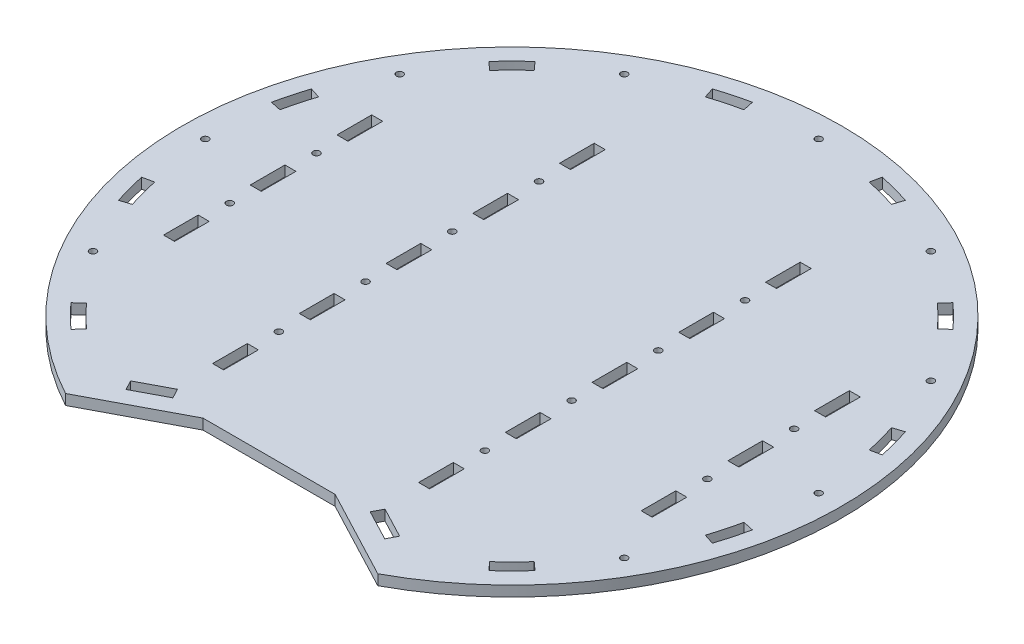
SolidWorks part; units mm, degrees
ref_plane "Front Plane" through (0, 0, 0) normal (0, 0, 1) x (1, 0, 0)
ref_plane "Top Plane" through (0, 0, 0) normal (0, 1, 0) x (1, 0, 0)
ref_plane "Right Plane" through (0, 0, 0) normal (1, 0, 0) x (0, 0, -1)
sketch "Sketch1" plane through (0, 0, 0) normal (0, 1, 0) x (1, 0, 0)
  line L0 (-106.3364, -157.4566) -> (-42.1421, -123.65) construction
  line L17 (-42.1421, -123.65) -> (42.1421, -123.65) construction
  line L18 (0, 190) -> (0, -190) construction
  line L19 (-137.675, -10) -> (-137.675, -40) construction
  line L20 (-190, 0) -> (190, 0) construction
  line L33 (140.85, -40) -> (140.85, -60)
  line L34 (-134.5, 40) -> (-140.85, 40)
  line L35 (-134.5, 40) -> (-134.5, 60)
  line L36 (-134.5, 60) -> (-140.85, 60)
  line L37 (-140.85, 40) -> (-140.85, 60)
  line L38 (-134.5, 10) -> (-140.85, 10)
  line L39 (-134.5, 10) -> (-134.5, -10)
  line L40 (-134.5, -10) -> (-140.85, -10)
  line L41 (-140.85, 10) -> (-140.85, -10)
  line L46 (-134.5, -40) -> (-140.85, -40)
  line L47 (-134.5, -40) -> (-134.5, -60)
  line L48 (-134.5, -60) -> (-140.85, -60)
  line L49 (-140.85, -40) -> (-140.85, -60)
  line L50 (134.5, -60) -> (140.85, -60)
  line L51 (134.5, -40) -> (134.5, -60)
  line L52 (134.5, -40) -> (140.85, -40)
  line L53 (140.85, 10) -> (140.85, -10)
  line L54 (134.5, -10) -> (140.85, -10)
  line L55 (134.5, 10) -> (134.5, -10)
  line L56 (134.5, 10) -> (140.85, 10)
  line L57 (140.85, 40) -> (140.85, 60)
  line L58 (134.5, 60) -> (140.85, 60)
  line L59 (134.5, 40) -> (134.5, 60)
  line L60 (134.5, 40) -> (140.85, 40)
  line L73 (42.1421, -123.65) -> (106.3364, -157.4566) construction
  line L86 (0, 0) -> (-37.4241, 176.0666) construction
  line L99 (-155.3051, -190) -> (147.1552, -190) construction
  line L100 (-128.4523, -140) -> (128.4523, -140) construction
  line L101 (-90, -167.332) -> (-38.1, -140)
  line L102 (-38.1, -140) -> (38.1, -140)
  line L103 (38.1, -140) -> (90, -167.332)
  line L104 (-53.6608, 165.151) -> (-55.6231, 171.1902)
  line L105 (0, 0) -> (-55.6231, 171.1902) construction
  line L126 (-137.675, 10) -> (-137.675, 40) construction
  line L127 (-37.4241, 176.0666) -> (-36.1039, 169.8553)
  line L128 (-100.2255, -161.4151) -> (-40.5722, -130) construction
  line L129 (-120.4435, 133.7661) -> (-116.1945, 129.0471)
  line L130 (-40.5722, -130) -> (40.5722, -130) construction
  line L131 (40.5722, -130) -> (100.2255, -161.4151) construction
  line L132 (-129.0471, 116.1945) -> (-133.7661, 120.4435)
  line L133 (-171.1902, 55.6231) -> (-165.151, 53.6608)
  line L134 (-169.8553, 36.1039) -> (-176.0666, 37.4241)
  line L135 (-176.0666, -37.4241) -> (-169.8553, -36.1039)
  line L136 (-165.151, -53.6608) -> (-171.1902, -55.6231)
  line L137 (-133.7661, -120.4435) -> (-129.0471, -116.1945)
  line L138 (-116.1945, -129.0471) -> (-120.4435, -133.7661)
  line L139 (0, 0) -> (-36.1039, 169.8553) construction
  line L140 (56.2033, -10) -> (62.5533, -10)
  line L141 (116.1945, -129.0471) -> (120.4435, -133.7661)
  line L142 (133.7661, -120.4435) -> (129.0471, -116.1945)
  line L143 (165.151, -53.6608) -> (171.1902, -55.6231)
  line L144 (176.0666, -37.4241) -> (169.8553, -36.1039)
  line L145 (169.8553, 36.1039) -> (176.0666, 37.4241)
  line L146 (171.1902, 55.6231) -> (165.151, 53.6608)
  line L147 (129.0471, 116.1945) -> (133.7661, 120.4435)
  line L148 (120.4435, 133.7661) -> (116.1945, 129.0471)
  line L149 (37.4241, 176.0666) -> (36.1039, 169.8553)
  line L150 (53.6608, 165.151) -> (55.6231, 171.1902)
  line L151 (-56.8793, -138.5878) -> (-59.8381, -132.9693)
  line L152 (-59.8381, -132.9693) -> (-77.5342, -142.2885)
  line L153 (-77.5342, -142.2885) -> (-74.5754, -147.907)
  line L154 (-74.5754, -147.907) -> (-56.8793, -138.5878)
  line L155 (77.5342, -142.2885) -> (74.5754, -147.907)
  line L156 (74.5754, -147.907) -> (56.8793, -138.5878)
  line L157 (56.8793, -138.5878) -> (59.8381, -132.9693)
  line L158 (59.8381, -132.9693) -> (77.5342, -142.2885)
  line L159 (-62.5533, 40) -> (-56.2033, 40)
  line L164 (-56.2033, 10) -> (-62.5533, 10)
  line L165 (-56.2033, 10) -> (-56.2033, -10)
  line L166 (-56.2033, -10) -> (-62.5533, -10)
  line L167 (-62.5533, 10) -> (-62.5533, -10)
  line L168 (-62.5533, 40) -> (-62.5533, 60)
  line L169 (-62.5533, 60) -> (-56.2033, 60)
  line L170 (-56.2033, 40) -> (-56.2033, 60)
  line L171 (-62.5533, 90) -> (-56.2033, 90)
  line L172 (-62.5533, 90) -> (-62.5533, 110)
  line L173 (-62.5533, 110) -> (-56.2033, 110)
  line L174 (-56.2033, 90) -> (-56.2033, 110)
  line L175 (-62.5533, -40) -> (-56.2033, -40)
  line L176 (-62.5533, -40) -> (-62.5533, -60)
  line L177 (-62.5533, -60) -> (-56.2033, -60)
  line L178 (-56.2033, -40) -> (-56.2033, -60)
  line L179 (-62.5533, -90) -> (-56.2033, -90)
  line L180 (-62.5533, -90) -> (-62.5533, -110)
  line L181 (-62.5533, -110) -> (-56.2033, -110)
  line L182 (-56.2033, -90) -> (-56.2033, -110)
  line L183 (62.5533, -60) -> (56.2033, -60)
  line L184 (56.2033, -40) -> (56.2033, -60)
  line L185 (62.5533, -40) -> (62.5533, -60)
  line L186 (62.5533, -40) -> (56.2033, -40)
  line L187 (62.5533, -110) -> (56.2033, -110)
  line L188 (62.5533, -90) -> (56.2033, -90)
  line L189 (56.2033, -90) -> (56.2033, -110)
  line L190 (62.5533, -90) -> (62.5533, -110)
  line L191 (56.2033, 90) -> (56.2033, 110)
  line L192 (62.5533, 110) -> (56.2033, 110)
  line L193 (62.5533, 90) -> (62.5533, 110)
  line L194 (62.5533, 90) -> (56.2033, 90)
  line L195 (56.2033, 40) -> (56.2033, 60)
  line L196 (62.5533, 60) -> (56.2033, 60)
  line L197 (62.5533, 40) -> (62.5533, 60)
  line L198 (62.5533, 10) -> (62.5533, -10)
  line L199 (56.2033, 10) -> (56.2033, -10)
  line L200 (56.2033, 10) -> (62.5533, 10)
  line L201 (62.5533, 40) -> (56.2033, 40)
  line L202 (-59.3783, 40) -> (-59.3783, 10) construction
  line L203 (-59.3783, -10) -> (-59.3783, -40) construction
  line L204 (-59.3783, 90) -> (-59.3783, 60) construction
  line L205 (-59.3783, -60) -> (-59.3783, -90) construction
  line L206 (0, 180) -> (0, 173.6114) construction
  line L207 (0, 0) -> (0, 176.8057) construction
  line L208 (0, 0) -> (-88.4029, 153.1182) construction
  circle A0 centre (0, 0) radius 190 construction
  arc A3 (-90, -167.332) -> (90, -167.332) centre (0, 0) cw
  circle A16 centre (0, 0) radius 180 construction
  circle A17 centre (0, 0) radius 173.65 construction
  arc A18 (-55.6231, 171.1902) -> (-37.4241, 176.0666) centre (0, 0) cw
  arc A19 (-53.6608, 165.151) -> (-36.1039, 169.8553) centre (0, 0) cw
  arc A20 (-133.7661, 120.4435) -> (-120.4435, 133.7661) centre (0, 0) cw
  arc A21 (-129.0471, 116.1945) -> (-116.1945, 129.0471) centre (0, 0) cw
  arc A22 (-176.0666, 37.4241) -> (-171.1902, 55.6231) centre (0, 0) cw
  arc A23 (-169.8553, 36.1039) -> (-165.151, 53.6608) centre (0, 0) cw
  arc A24 (-171.1902, -55.6231) -> (-176.0666, -37.4241) centre (0, 0) cw
  arc A25 (-165.151, -53.6608) -> (-169.8553, -36.1039) centre (0, 0) cw
  arc A26 (-120.4435, -133.7661) -> (-133.7661, -120.4435) centre (0, 0) cw
  arc A27 (-116.1945, -129.0471) -> (-129.0471, -116.1945) centre (0, 0) cw
  arc A28 (120.4435, -133.7661) -> (133.7661, -120.4435) centre (0, 0) ccw
  arc A29 (116.1945, -129.0471) -> (129.0471, -116.1945) centre (0, 0) ccw
  arc A30 (165.151, -53.6608) -> (169.8553, -36.1039) centre (0, 0) ccw
  arc A31 (171.1902, -55.6231) -> (176.0666, -37.4241) centre (0, 0) ccw
  arc A32 (176.0666, 37.4241) -> (171.1902, 55.6231) centre (0, 0) ccw
  arc A33 (169.8553, 36.1039) -> (165.151, 53.6608) centre (0, 0) ccw
  arc A34 (133.7661, 120.4435) -> (120.4435, 133.7661) centre (0, 0) ccw
  arc A35 (129.0471, 116.1945) -> (116.1945, 129.0471) centre (0, 0) ccw
  arc A36 (53.6608, 165.151) -> (36.1039, 169.8553) centre (0, 0) ccw
  arc A37 (55.6231, 171.1902) -> (37.4241, 176.0666) centre (0, 0) ccw
  circle A38 centre (-137.675, 25) radius 1.9558
  circle A39 centre (-137.675, -25) radius 1.9558
  circle A40 centre (-59.3783, -25) radius 1.9558
  circle A41 centre (-59.3783, -75) radius 1.9558
  circle A42 centre (-59.3783, 25) radius 1.9558
  circle A43 centre (-59.3783, 75) radius 1.9558
  circle A44 centre (0, 176.8057) radius 1.9558
  circle A45 centre (-88.4029, 153.1182) radius 1.9558
  circle A46 centre (-153.1182, 88.4029) radius 1.9558
  circle A47 centre (-176.8057, 0) radius 1.9558
  circle A48 centre (-153.1182, -88.4029) radius 1.9558
  circle A49 centre (88.4029, 153.1182) radius 1.9558
  circle A50 centre (59.3783, -75) radius 1.9558
  circle A51 centre (153.1182, -88.4029) radius 1.9558
  circle A52 centre (176.8057, 0) radius 1.9558
  circle A53 centre (153.1182, 88.4029) radius 1.9558
  circle A54 centre (137.675, -25) radius 1.9558
  circle A55 centre (59.3783, -25) radius 1.9558
  circle A56 centre (59.3783, 25) radius 1.9558
  circle A57 centre (137.675, 25) radius 1.9558
  circle A58 centre (59.3783, 75) radius 1.9558
  point P71 (-59.3783, 90)
  point P116 (0, -140)
  point P199 (-56.2033, 0)
  dimension "D1" = 380
  dimension "D5" = 3.9116
  dimension "D30" = 360
  dimension "D31" = 347.3
  dimension "D38" = 20
  dimension "D6" = 6.35
  dimension "D7" = 71.9467
  dimension "D8" = 20
  dimension "D9" = 30
  dimension "D10" = 30
  dimension "D11" = 30
  dimension "D12" = 5
  dimension "D13" = 30
  dimension "D16" = 6.35
  dimension "D17" = 50
  dimension "D18" = 76.2
  dimension "D19" = 6.35
  dimension "D20" = 6.35
  dimension "D21" = 30
  dimension "D22" = 30
  dimension "D28" = 6
  dimension "D29" = 12
  dimension "D32" = 10
  dimension "D33" = 10
  dimension "D34" = 10
  dimension "D35" = 5
  dimension "D39" = 20
  dimension "D41" = 20
extrude "Boss-Extrude1" add sketch "Sketch1" along normal blind 6
